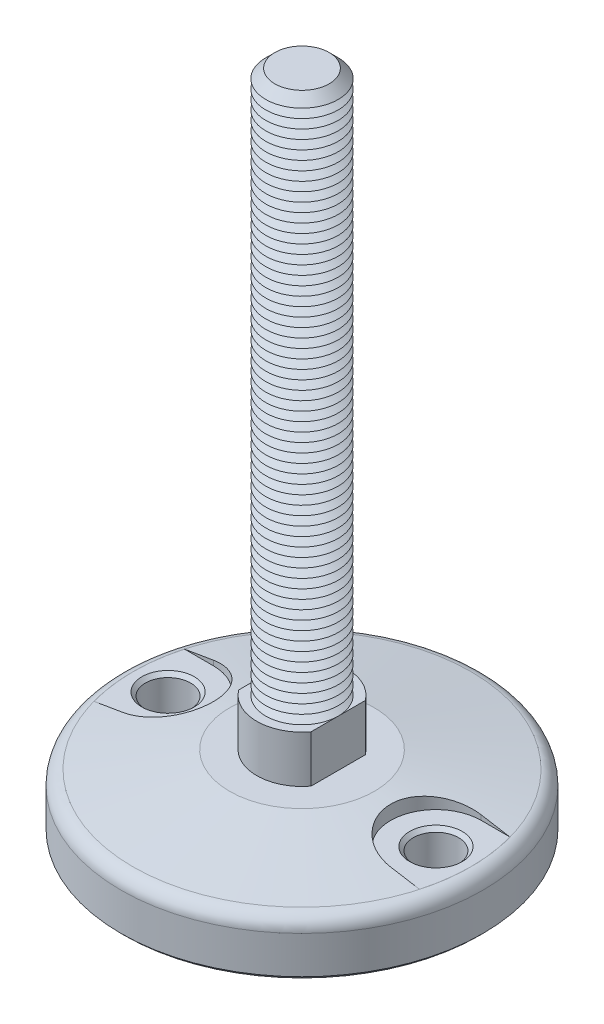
SolidWorks part; units mm, degrees
ref_plane "Front Plane" through (0, 0, 0) normal (0, 0, 1) x (1, 0, 0)
ref_plane "Top Plane" through (0, 0, 0) normal (0, 1, 0) x (1, 0, 0)
ref_plane "Right Plane" through (0, 0, 0) normal (1, 0, 0) x (0, 0, -1)
sketch "Sketch1" plane through (0, 0, 0) normal (1, 0, 0) x (0, 0, -1)
  line L0 (0, 61.3389) -> (0, -58.404) construction
sketch "Sketch2" plane through (0, 0, 0) normal (1, 0, 0) x (0, 0, -1)
  line L0 (0, 0) -> (-20, 0)
  line L1 (-20, 0) -> (-50, -5.2898)
  line L2 (-50, -5.2898) -> (-50, -20)
  line L3 (-50, -20) -> (0, -20)
  line L4 (0, 61.3389) -> (0, -58.404) construction
  line L5 (0, -20) -> (0, 0)
  dimension "D1" = 20
  dimension "D2" = 50
  dimension "D3" = 20
  dimension "D4" = 10
revolve "Revolve1" add sketch "Sketch2" angle 360 about L0
fillet "Fillet1" radius 4 1 edges at (0, -5.2898, 50)
sketch "Sketch3" plane through (0, 0, 0) normal (0, 1, 0) x (1, 0, 0)
  circle A0 centre (0, 0) radius 12.5
  dimension "D1" = 25
extrude "Boss-Extrude1" add sketch "Sketch3" along normal blind 13
sketch "Sketch4" plane through (0, 13, 0) normal (0, 1, 0) x (1, 0, 0)
  line L0 (-10, 7.5) -> (-10, -7.5)
  line L2 (10, -7.5) -> (10, 7.5)
  arc A0 (-10, 7.5) -> (-10, -7.5) centre (0, 0) ccw
  circle A1 centre (0, 0) radius 12.5 construction
  arc A2 (10, -7.5) -> (10, 7.5) centre (0, 0) ccw
  dimension "D1" = 20
extrude "Cut-Extrude1" cut sketch "Sketch4" against normal blind 13
sketch "Sketch5" plane through (0, 13, 0) normal (0, 1, 0) x (1, 0, 0)
  circle A0 centre (0, 0) radius 10
  dimension "D1" = 20
extrude "Boss-Extrude2" add sketch "Sketch5" along normal blind 150
chamfer "Chamfer1" distance 2.5 angle 45 1 edges at (0, 163, 10)
sketch "Sketch6" plane through (0, 0, 0) normal (1, 0, 0) x (0, 0, -1)
  line L0 (-10, 13) -> (-7.8349, 14.25)
  line L1 (-7.8349, 14.25) -> (-10, 15.5)
  line L2 (-10, 160.5) -> (-10, 13) construction
  line L3 (-10, 15.5) -> (-10, 13)
  dimension "D1" = 2.5
revolve "Cut-Revolve1" cut sketch "Sketch6" angle 360 about L0
pattern_linear "LPattern1" count 59 spacing 2.5 along (0, 1, 0) of "Cut-Revolve1"
sketch "Sketch8" plane through (0, 0, 0) normal (0, 1, 0) x (1, 0, 0)
  line L0 (-37, 12.5) -> (-44.9904, 12.5)
  line L1 (-37, -12.5) -> (-44.9904, -12.5)
  arc A1 (-44.9904, 12.5) -> (-44.9904, -12.5) centre (0, 0) ccw
  circle A2 centre (0, 0) radius 46.6946 construction
  arc A3 (-37, -12.5) -> (-37, 12.5) centre (-37, 0) ccw
  point P3 (-37, 0)
  point P11 (0, 0)
  dimension "D1" = 37
  dimension "D2" = 25
extrude "Cut-Extrude4" cut sketch "Sketch8" against normal blind 4.7
sketch "Sketch10" plane through (0, -4.7, 0) normal (0, 1, 0) x (1, 0, 0)
  circle A0 centre (-37, 0) radius 6.25
  dimension "D1" = 12.5
extrude "Cut-Extrude5" cut sketch "Sketch10" against normal up to surface (15.3 mm away)
chamfer "Chamfer2" distance 1 angle 45 2 edges at (-37, -20, -6.25) (-37, -4.7, 6.25)
mirror "Mirror1" about plane through (0, 0, 0) normal (1, 0, 0) of "Chamfer2", "Cut-Extrude5", "Cut-Extrude4"
chamfer "Chamfer3" distance 1 angle 45 1 edges at (0, -20, 50)
